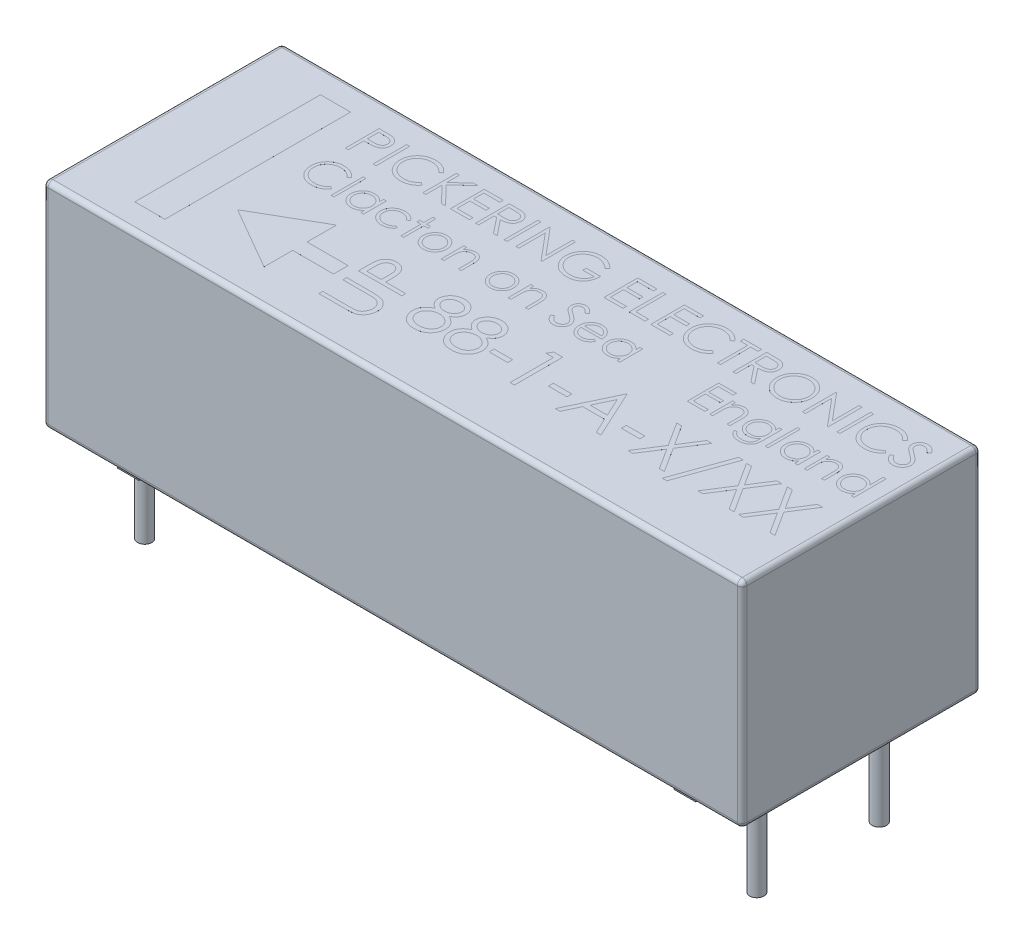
SolidWorks part; units mm, degrees
ref_plane "Front Plane" through (0, 0, 0) normal (0, 0, 1) x (1, 0, 0)
ref_plane "Top Plane" through (0, 0, 0) normal (0, 1, 0) x (1, 0, 0)
ref_plane "Right Plane" through (0, 0, 0) normal (1, 0, 0) x (0, 0, -1)
sketch "Sketch2" plane through (0, 0, 0) normal (0, 1, 0) x (1, 0, 0)
  line L1 (14.5, -4.95) -> (-14.5, -4.95)
  line L2 (14.5, -4.95) -> (14.5, 4.95)
  line L3 (14.5, 4.95) -> (-14.5, 4.95)
  line L4 (-14.5, -4.95) -> (-14.5, 4.95)
  line L5 (14.5, -4.95) -> (-14.5, 4.95) construction
  line L6 (14.5, 4.95) -> (-14.5, -4.95) construction
  point P0 (0, 0)
  dimension "D1" = 9.9
  dimension "D2" = 29
extrude "Main Body" add sketch "Sketch2" along normal blind 8.89 draft 0.023
sketch "Sketch3"
  dimension "D1" = 1.25
  dimension "D2" = 7.7
  dimension "D3" = 1.0965
  dimension "D4" = 2.7
  dimension "D5" = 1.4
  dimension "D6" = 2
extrude "Lettering" add sketch "Sketch3" along normal blind 0.0001
sketch "Sketch4" plane through (0, 0, 0) normal (0, -1, 0) x (1, 0, 0)
  line L0 (-14.5, -4.95) -> (-14.5, 4.95) construction
  line L1 (-12, 4.375) -> (-11.1, 4.375)
  line L2 (-12, 4.375) -> (-12, -4.375)
  line L3 (-12, -4.375) -> (-11.1, -4.375)
  line L4 (-11.1, 4.375) -> (-11.1, -4.375)
  line L5 (-14.5, 4.95) -> (14.5, 4.95) construction
  dimension "D1" = 8.75
  dimension "D2" = 0.9
  dimension "D3" = 2.5
  dimension "D4" = 0.575
extrude "Bobbin feet" add sketch "Sketch4" along normal blind 0.51
sketch "Sketch5" plane through (0, -0.51, 0) normal (0, -1, 0) x (1, 0, 0)
  line L0 (-11.1, -4.375) -> (-11.1, 4.375) construction
  line L1 (-11.1, -2.9375) -> (-12, -2.9375)
  line L2 (-11.1, -2.9375) -> (-11.1, -1.9375)
  line L3 (-11.1, -1.9375) -> (-12, -1.9375)
  line L4 (-12, -2.9375) -> (-12, -1.9375)
  line L5 (-12, 4.375) -> (-12, -4.375) construction
  line L6 (-12, 4.375) -> (-12, -4.375) construction
  line L7 (-12, -0.5) -> (-11.1, -0.5)
  line L8 (-12, -0.5) -> (-12, 0.5)
  line L9 (-12, 0.5) -> (-11.1, 0.5)
  line L10 (-11.1, -0.5) -> (-11.1, 0.5)
  line L11 (-11.1, 1.9375) -> (-12, 1.9375)
  line L12 (-11.1, 1.9375) -> (-11.1, 2.9375)
  line L13 (-11.1, 2.9375) -> (-12, 2.9375)
  line L14 (-12, 1.9375) -> (-12, 2.9375)
  line L15 (-12, -4.375) -> (-11.1, -4.375) construction
  dimension "D1" = 1.4375
  dimension "D2" = 1
  dimension "D3" = 1.4375
  dimension "D4" = 1
  dimension "D5" = 1
  dimension "D6" = 1.4375
extrude "Bobbin feet cut" cut sketch "Sketch5" against normal up to surface (0.51 mm away)
sketch "Sketch8" plane through (0, 0, 0) normal (0, -1, 0) x (1, 0, 0)
  line L0 (-14.5, -4.95) -> (-14.5, 4.95) construction
  line L1 (-12, -4.375) -> (-13.925, -4.375)
  line L2 (-12, -4.375) -> (-12, -2.9375)
  line L3 (-12, -2.9375) -> (-13.925, -2.9375)
  line L4 (-13.925, -4.375) -> (-13.925, -2.9375)
  line L5 (-12, -2.9375) -> (-11.1, -2.9375) construction
  dimension "D1" = 0.575
extrude "Extrude5" add sketch "Sketch8" along normal blind 0.1
pattern_linear "LPattern1" count 4 spacing 2.4385 along (0, 0, 1) of "Extrude5"
mirror "Mirror1" about plane through (0, 0, 0) normal (1, 0, 0) of "Extrude5", "Bobbin feet cut", "Bobbin feet", "LPattern1"
sketch "Sketch9" plane through (0, 0, 0) normal (0, -1, 0) x (1, 0, 0)
  line L0 (14.5, -4.95) -> (-14.5, -4.95) construction
  line L1 (14.5, 4.95) -> (14.5, -4.95) construction
  circle A0 centre (12.7, -2.54) radius 0.3
  circle A1 centre (12.7, 2.54) radius 0.2963
  dimension "D1" = 0.6
  dimension "D2" = 2.41
  dimension "D3" = 5.08
  dimension "D4" = 1.8
extrude "Pins" add sketch "Sketch9" along normal blind 4.31
mirror "Mirror2" about plane through (0, 0, 0) normal (1, 0, 0) of "Pins"
fillet "Fillet1" radius 0.2 12 edges at (0, 0, -4.95) (-14.5, 0, 0) (0, 0, 4.95) (14.5, 0, 0) (14.4983, 4.445, -4.9483) (14.4965, 8.89, 0) (14.4983, 4.445, 4.9483) (0, 8.89, -4.9465) (-14.4983, 4.445, -4.9483) (-14.4983, 4.445, 4.9483) (0, 8.89, 4.9465) (-14.4965, 8.89, 0)
sketch "Sketch10"
sketch_block_instance "UP-1"
sketch_block "UP"
sketch_block_instance "Block1-1"
sketch_block "Block1" parameters "D1"=1.7, "D2"=2.2, "D3"=2.6, "D4"=1.24
extrude "Arrow" add sketch "Sketch10" along normal blind 0.0001
